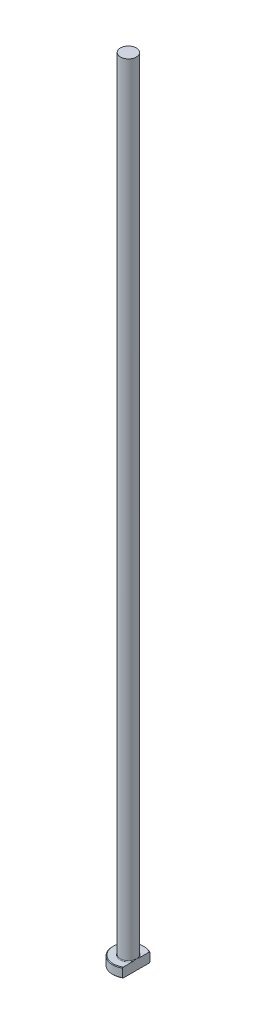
SolidWorks part; units mm, degrees
ref_plane "Front Plane" through (0, 0, 0) normal (0, 0, 1) x (1, 0, 0)
ref_plane "Top Plane" through (0, 0, 0) normal (0, 1, 0) x (1, 0, 0)
ref_plane "Right Plane" through (0, 0, 0) normal (1, 0, 0) x (0, 0, -1)
sketch "Sketch1" plane through (0, 0, 0) normal (0, 0, 1) x (1, 0, 0)
  line L0 (0, 259.9588) -> (0, -15.1925) construction
  line L1 (0, 0) -> (-5, 0)
  line L2 (-5, 0) -> (-5, 3)
  line L3 (-5, 3) -> (-2.5, 3)
  line L4 (-2.5, 3) -> (-2.5, 250)
  line L5 (-2.5, 250) -> (0, 250)
  line L6 (0, 250) -> (0, 0)
  dimension "L" = 250
  dimension "H" = 10
  dimension "T" = 3
  dimension "D" = 5
revolve "Revolve1" add sketch "Sketch1" angle 360 about L0
chamfer "Chamfer1" distance 0.2 angle 45 2 edges at (0, 3, 5) (0, 0, 5)
fillet "Fillet1" radius 0.2 1 edges at (0, 3, 2.5)
sketch "Sketch2" plane through (0, 0, 0) normal (0, 1, 0) x (1, 0, 0)
  line L0 (2.5, 4.3301) -> (2.5, -4.3301)
  circle A0 centre (0, 0) radius 5 construction
  arc A1 (2.5, -4.3301) -> (2.5, 4.3301) centre (0, 0) ccw
  circle A2 centre (0, 0) radius 2.5 construction
extrude "KEY" cut sketch "Sketch2" along normal through all
